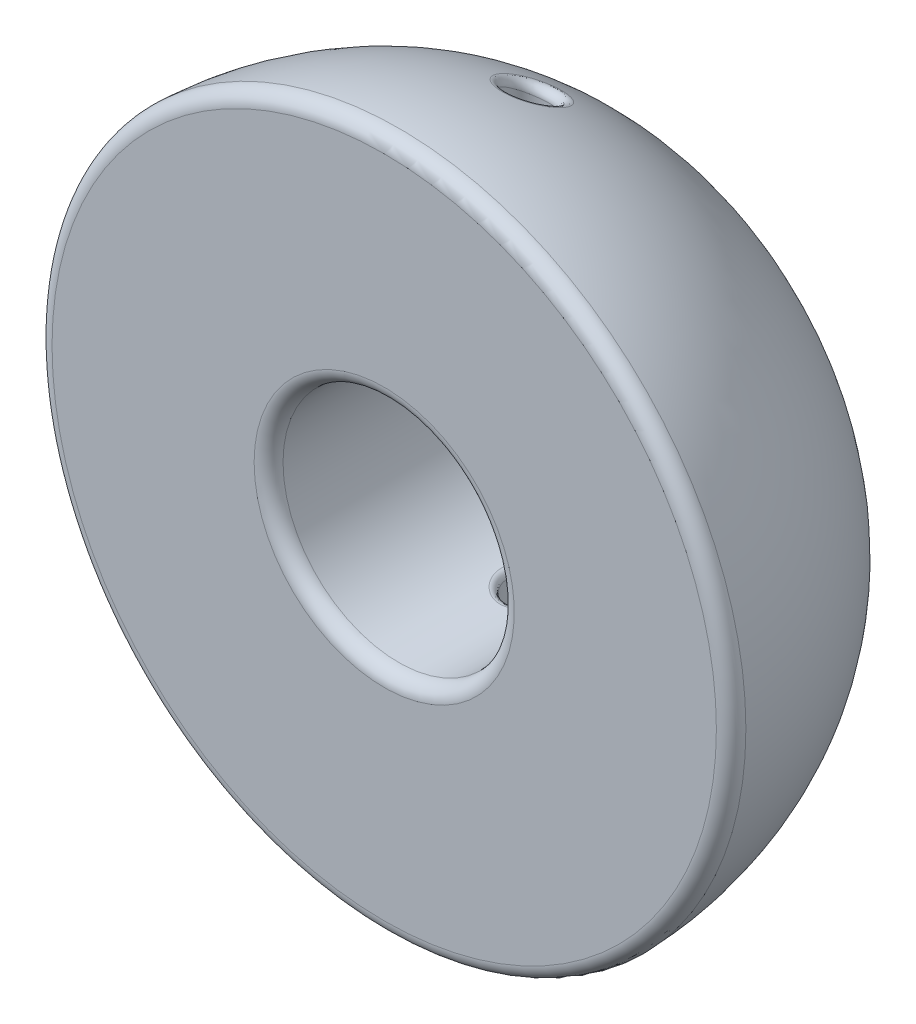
SolidWorks part; units mm, degrees
ref_plane "Спереди" through (0, 0, 0) normal (0, 0, 1) x (1, 0, 0)
ref_plane "Сверху" through (0, 0, 0) normal (0, 1, 0) x (1, 0, 0)
ref_plane "Справа" through (0, 0, 0) normal (1, 0, 0) x (0, 0, -1)
sketch "Эскиз1" plane through (0, 0, 0) normal (1, 0, 0) x (0, 0, -1)
  line L0 (-5, 0) -> (5, 0) construction
  line L1 (-5, 12) -> (-5, 4)
  line L2 (-5, 4) -> (5, 4)
  ellipse E0 centre (-5, 4) end of major axis (5, 4) minor radius 8 (5, 4) -> (-5, 12) ccw
  dimension "D1" = 10
  dimension "D2" = 8
  dimension "D3" = 24
revolve "Повернуть1" add sketch "Эскиз1" angle 360 about L0
fillet "Скругление1" radius 0.5 3 edges at (4, 0, 5) (4, 0, -5) (12, 0, 5)
sketch "Эскиз2" plane through (0, 0, 0) normal (0, 1, 0) x (1, 0, 0)
  circle A0 centre (0, 0) radius 0.75
  dimension "D1" = 1.5
extrude "Вырез-Вытянуть1" cut sketch "Эскиз2" against normal mid plane 30
fillet "Скругление2" radius 0.25 4 edges at (0.173, 10.5552, -0.7298) (-0.173, -10.5552, -0.7298) (0.1578, -3.9969, -0.7332) (-0.1578, 3.9969, -0.7332)
